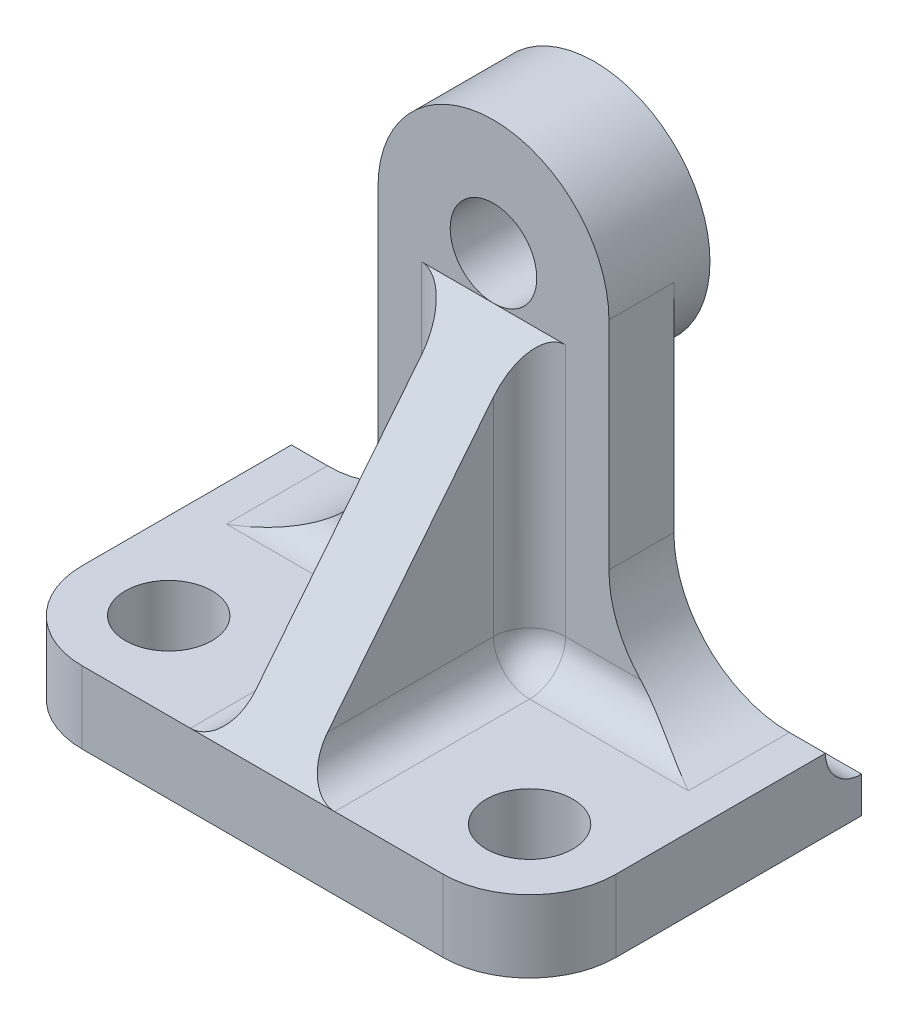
SolidWorks part; units mm, degrees
ref_plane "Front Plane" through (0, 0, 0) normal (0, 0, 1) x (1, 0, 0)
ref_plane "Top Plane" through (0, 0, 0) normal (0, 1, 0) x (1, 0, 0)
ref_plane "Right Plane" through (0, 0, 0) normal (1, 0, 0) x (0, 0, -1)
sketch "Sketch8" plane through (0, 0, 0) normal (0, 0, 1) x (1, 0, 0)
  line L1 (-32.7822, 0) -> (41.2178, 0)
  line L2 (-32.7822, 0) -> (-32.7822, -10)
  line L3 (-32.7822, -10) -> (41.2178, -10)
  line L4 (41.2178, 0) -> (41.2178, -10)
  dimension "D1" = 74
  dimension "D2" = 10
extrude "Boss-Extrude9" add sketch "Sketch8" along normal blind 46 contours L1 L4 L3 L2
fillet "Fillet8" radius 12 1 edges at (-32.7822, -5, 46)
fillet "Fillet9" radius 12 1 edges at (41.2178, -5, 46)
sketch "Sketch10" plane through (-32.7822, 0, 0) normal (-1, 0, 0) x (0, 0, 1)
  line L0 (34, 0) -> (0, 0) construction
  line L1 (0, 0) -> (0, -10) construction
  arc A0 (5, 0) -> (0, -5) centre (0, 0) cw
  dimension "D1" = 5
extrude "Cut-Extrude3" cut sketch "Sketch10" against normal through all and the other way through all flip side to cut
ref_plane "Plane2" through (4.2178, 0, 0) normal (-1, 0, 0) x (0, 0, 1)
sketch "Sketch13" plane through (0, 0, 0) normal (0, 0, 1) x (1, 0, 0)
  line L1 (-32.7822, 0) -> (41.2178, 0) construction
  line L2 (-11.7822, 0) -> (20.2178, 0)
  line L3 (-11.7822, 0) -> (-11.7822, 46)
  line L5 (20.2178, 0) -> (20.2178, 46)
  line L6 (4.2178, 46.9442) -> (4.2178, -46.9442) construction
  arc A0 (-11.7822, 46) -> (20.2178, 46) centre (4.2178, 46) cw
  circle A1 centre (4.2178, 46) radius 6
  dimension "D2" = 16
  dimension "D3" = 12
  dimension "D1" = 46
extrude "Boss-Extrude10" add sketch "Sketch13" along normal blind 14
sketch "Sketch15" plane through (-11.7822, 0, 0) normal (-1, 0, 0) x (0, 0, 1)
  line L0 (0, 46) -> (0, 0) construction
  line L1 (0, 46) -> (5, 46)
  line L2 (0, 46) -> (0, 0)
  line L3 (0, 0) -> (5, 0)
  line L4 (5, 46) -> (5, 0)
  line L5 (14, 46) -> (0, 46) construction
extrude "Cut-Extrude4" cut sketch "Sketch15" against normal up to next
sketch "Sketch26" plane through (0, 0, 0) normal (0, 0, -1) x (-1, 0, 0)
  circle A0 centre (-4.2178, 46) radius 16
extrude "Boss-Extrude11" add sketch "Sketch26" against normal blind 14
sketch "Sketch27" plane through (0, 0, 0) normal (0, 0, -1) x (-1, 0, 0)
  line L0 (-4.2178, 62) -> (-4.2178, 30) construction
  line L1 (-20.2178, 46) -> (11.7822, 46) construction
  circle A3 centre (-4.2178, 46) radius 16 construction
fillet "Fillet11" radius 5 1 edges at (4.2178, 0, 14)
fillet "Fillet12" radius 16 2 edges at (-11.7822, 0, 12) (20.2178, 0, 12)
sketch "Sketch28" plane through (0, 0, 0) normal (0, 0, -1) x (-1, 0, 0)
  line L0 (-4.2178, 62) -> (-4.2178, 30) construction
  circle A0 centre (-4.2178, 46) radius 6
  dimension "D1" = 12
extrude "Cut-Extrude5" cut sketch "Sketch28" against normal through all
sketch "Sketch31" plane through (4.2178, 0, 0) normal (-1, 0, 0) x (0, 0, 1)
  line L0 (14, 40) -> (46, 0)
rib "Rib2" sketch "Sketch31" sketch "Sketch31" thickness 10 extrusion direction parallel to sketch draft on no parameters "D1"=10
fillet "Fillet13" radius 5 6 edges at (9.2178, 22.5, 14) (9.2178, 1.4645, 15.4645) (-0.7822, 22.5, 14) (-0.7822, 1.4645, 15.4645) (9.2178, 0, 32.5) (-0.7822, 0, 32.5)
sketch "Sketch36" plane through (0, 0, 0) normal (0, 1, 0) x (1, 0, 0)
  line L0 (-20.7822, -34) -> (29.2178, -34) construction
  line L1 (-20.7822, -19.8724) -> (-20.7822, -51.3013) construction
  line L2 (29.2178, -19) -> (29.2178, -60.5263) construction
  line L3 (36.2178, -19) -> (14.2178, -19) construction
  circle A0 centre (-20.7822, -34) radius 6
  circle A1 centre (29.2178, -34) radius 6
  arc A4 (-32.7822, -34) -> (-20.7822, -46) centre (-20.7822, -34) ccw construction
  arc A6 (29.2178, -46) -> (41.2178, -34) centre (29.2178, -34) ccw construction
  point P14 (-29.2675, -42.4853)
  point P19 (37.7031, -42.4853)
  dimension "D2" = 12
  dimension "D3" = 12
  dimension "D4" = 12
  dimension "D1" = 12
  dimension "D5" = 50
  dimension "D6" = 50
extrude "Cut-Extrude6" cut sketch "Sketch36" against normal through all
